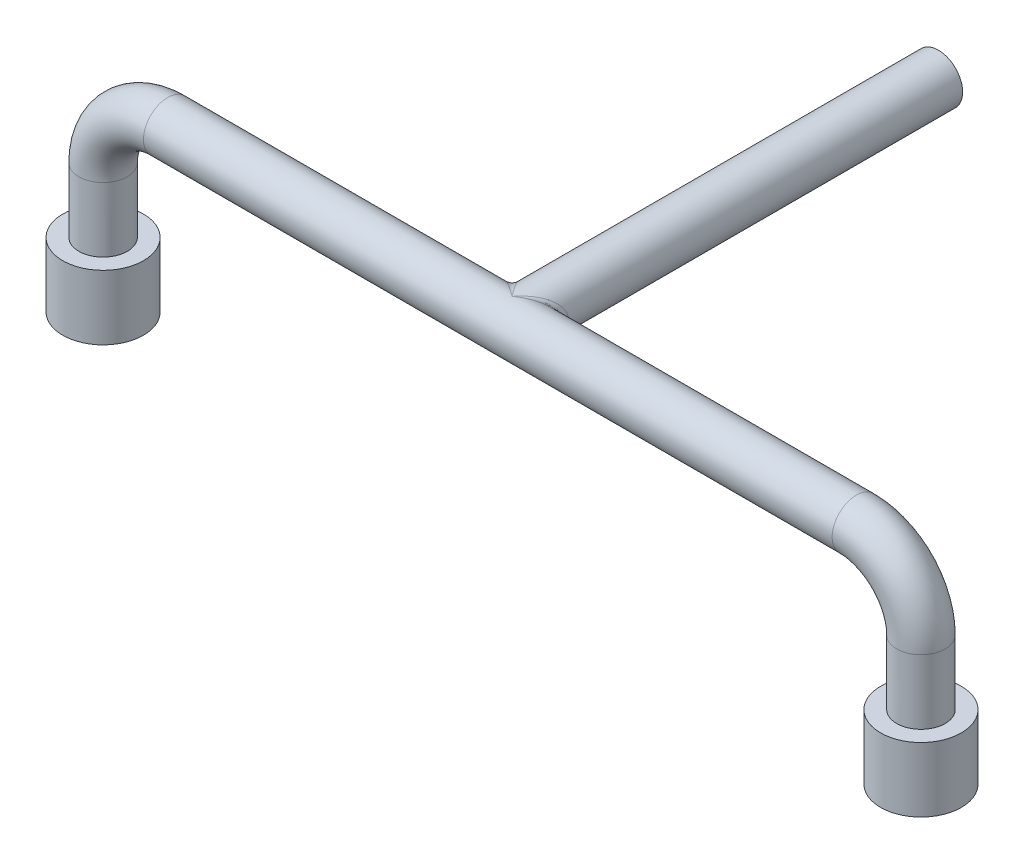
SolidWorks part; units mm, degrees
ref_plane "Front Plane" through (0, 0, 0) normal (0, 0, 1) x (1, 0, 0)
ref_plane "Top Plane" through (0, 0, 0) normal (0, 1, 0) x (1, 0, 0)
ref_plane "Right Plane" through (0, 0, 0) normal (1, 0, 0) x (0, 0, -1)
sketch "Sketch1" plane through (0, 0, 0) normal (0, 0, 1) x (1, 0, 0)
  line L0 (-80.391, 0) -> (-80.391, 12.7)
  line L1 (-67.691, 25.4) -> (67.691, 25.4)
  line L2 (80.391, 12.7) -> (80.391, 0)
  line L3 (80.391, 0) -> (-80.391, 0) construction
  arc A0 (-80.391, 12.7) -> (-67.691, 25.4) centre (-67.691, 12.7) cw
  arc A1 (67.691, 25.4) -> (80.391, 12.7) centre (67.691, 12.7) cw
  point P7 (-80.391, 25.4)
  point P10 (80.391, 25.4)
  dimension "D3" = 12.7
  dimension "D1" = 160.782
  dimension "D2" = 25.4
sketch "Sketch2" plane through (0, 0, 0) normal (0, 1, 0) x (1, 0, 0)
  circle A0 centre (-80.391, 0) radius 4.7625
  dimension "D1" = 9.525
sweep "Sweep1" add profiles "Sketch2" path "Sketch1"
sketch "Sketch3" plane through (0, 0, 0) normal (0, -1, 0) x (1, 0, 0)
  circle A0 centre (-80.391, 0) radius 7.9375
  dimension "D1" = 15.875
extrude "Extrude1" add sketch "Sketch3" along normal blind 12.7
sketch "Sketch4" plane through (149.9698, 0, -0.5805) normal (0, -1, 0) x (1, 0, 0)
  circle A0 centre (-69.5788, 0.5805) radius 7.9375
  dimension "D1" = 15.875
extrude "Extrude2" add sketch "Sketch4" along normal blind 12.7
sketch "Sketch5" plane through (0, 0, 0) normal (0, 0, 1) x (1, 0, 0)
  line L0 (-67.691, 25.4) -> (67.691, 25.4) construction
  line L1 (67.691, 30.1625) -> (-67.691, 30.1625) construction
  circle A0 centre (0, 25.4) radius 4.7625
extrude "Extrude3" add sketch "Sketch5" against normal blind 83.82
fillet "Fillet1" radius 1.5875 2 edges at (-4.7625, 25.4, -4.7625) (4.7625, 25.4, -4.7625)
